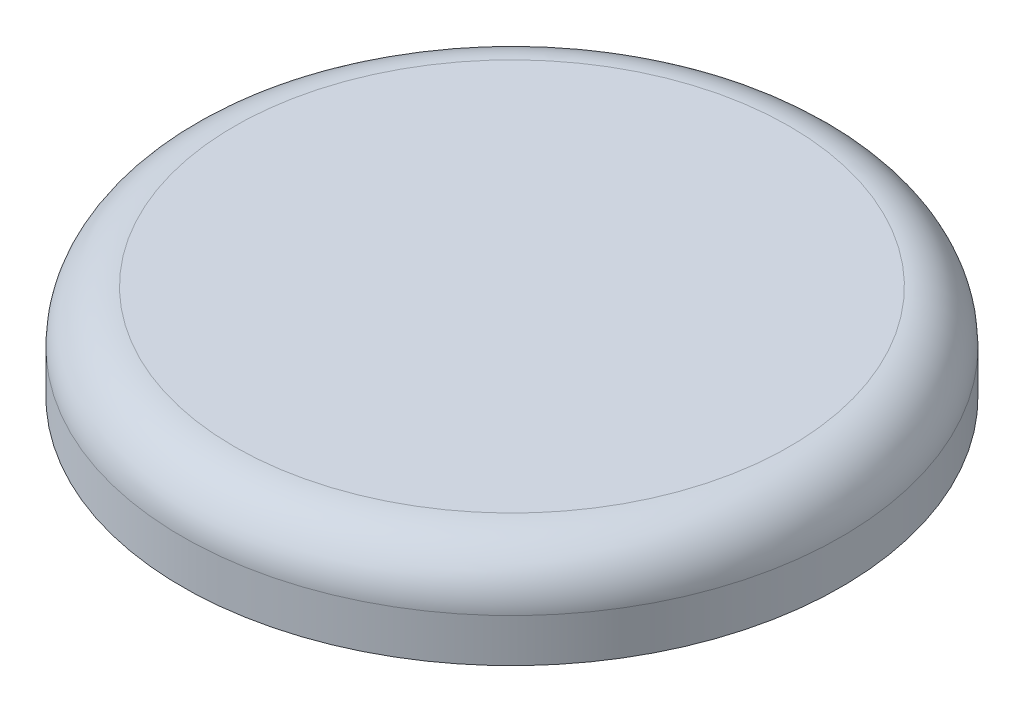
SolidWorks part; units mm, degrees
ref_plane "Plan de face" through (0, 0, 0) normal (0, 0, 1) x (1, 0, 0)
ref_plane "Plan de dessus" through (0, 0, 0) normal (0, 1, 0) x (1, 0, 0)
ref_plane "Plan de droite" through (0, 0, 0) normal (1, 0, 0) x (0, 0, -1)
sketch "Esquisse1" plane through (0, 0, 0) normal (0, 0, 1) x (1, 0, 0)
  line L0 (0, 0) -> (0, 59.9602) construction
  line L1 (0, -55) -> (0, 55) construction
  line L2 (0, 0) -> (-19, 0)
  line L3 (-19, 0) -> (-19, -5.5)
  line L4 (-19, -5.5) -> (-16.5, -5.5)
  line L5 (-16.5, -5.5) -> (-16.1938, -2)
  line L6 (-16.1938, -2) -> (-7.65, -2)
  line L7 (-7.65, -2) -> (-7.2221, -11.8)
  line L8 (-5.9, -11.8) -> (-5.5578, -2)
  line L10 (-5.5578, -2) -> (0, -2)
  line L11 (0, -2) -> (0, 0)
  line L14 (-7.2221, -11.8) -> (-5.9, -11.8)
  dimension "D1" = 38
  dimension "D2" = 9.8
  dimension "D3" = 11.8
  dimension "D4" = 2
  dimension "D5" = 5
  dimension "D6" = 5.5
  dimension "D7" = 2.5
  dimension "D8" = 15.3
  dimension "D9" = 2
  dimension "D10" = 2.5
revolve "Révolution1" add sketch "Esquisse1" angle 360 about L0
fillet "Congé1" radius 3 1 edges at (0, 0, -19)
fillet "Congé2" radius 1 1 edges at (0, -2, -16.1938)
sketch "Esquisse2" plane through (0, 0, 0) normal (0, 0, 1) x (1, 0, 0)
  line L0 (0, 0.6609) -> (0, -21.1346) construction
  line L1 (0, -6.49) -> (0, 6.49) construction
  line L2 (7.2221, -11.8) -> (7.65, -2) construction
  line L3 (7.4006, -7.7121) -> (7.4576, -6.4057)
  line L5 (-15.2775, -2) -> (15.2775, -2) construction
  arc A0 (7.4576, -6.4057) -> (7.4006, -7.7121) centre (6.0804, -7) cw
  dimension "D2" = 1.5
  dimension "D3" = 0.15
  dimension "D1" = 5
revolve "Révolution2" add sketch "Esquisse2" angle 360 about L0
scale "Echelle1" scale about origin uniform scaling yes scale factor 1.018
